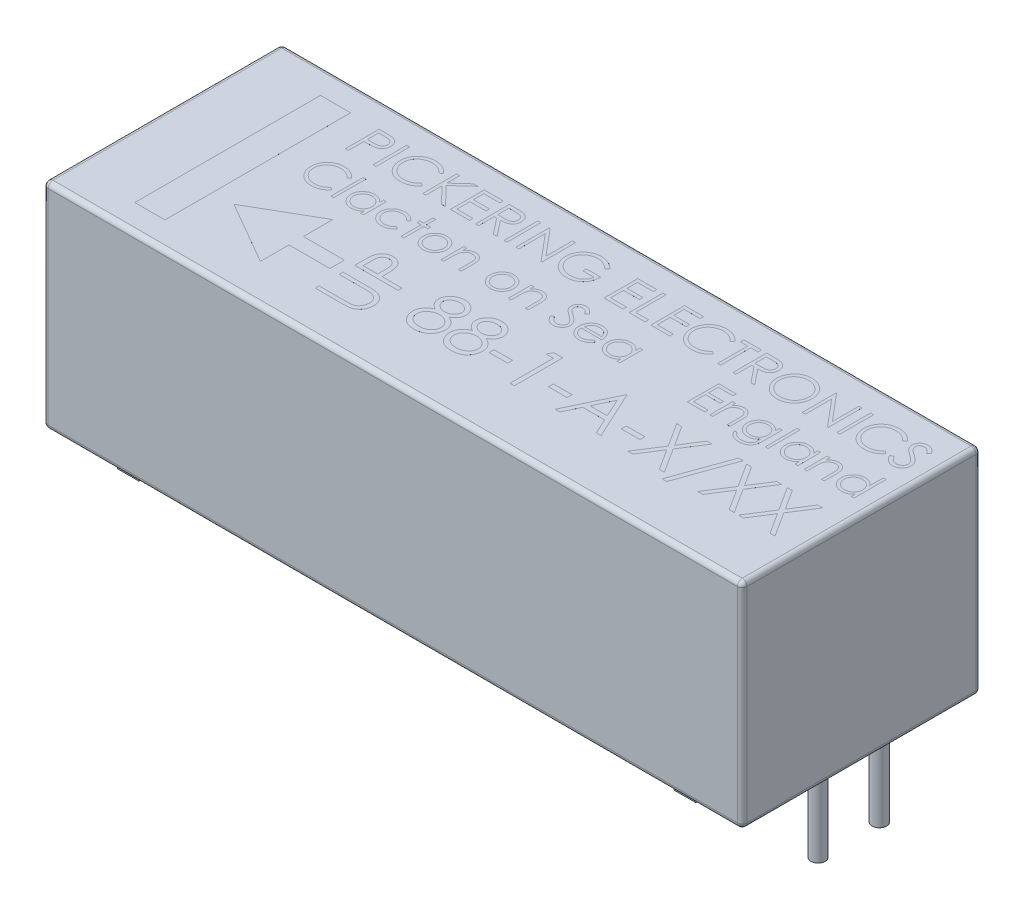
SolidWorks part; units mm, degrees
ref_plane "Front Plane" through (0, 0, 0) normal (0, 0, 1) x (1, 0, 0)
ref_plane "Top Plane" through (0, 0, 0) normal (0, 1, 0) x (1, 0, 0)
ref_plane "Right Plane" through (0, 0, 0) normal (1, 0, 0) x (0, 0, -1)
sketch "Sketch2" plane through (0, 0, 0) normal (0, 1, 0) x (1, 0, 0)
  line L1 (14.5, -4.95) -> (-14.5, -4.95)
  line L2 (14.5, -4.95) -> (14.5, 4.95)
  line L3 (14.5, 4.95) -> (-14.5, 4.95)
  line L4 (-14.5, -4.95) -> (-14.5, 4.95)
  line L5 (14.5, -4.95) -> (-14.5, 4.95) construction
  line L6 (14.5, 4.95) -> (-14.5, -4.95) construction
  point P0 (0, 0)
  dimension "D1" = 9.9
  dimension "D2" = 29
extrude "Main Body" add sketch "Sketch2" along normal blind 8.89 draft 0.023
sketch "Sketch3"
  dimension "D1" = 1.25
  dimension "D2" = 7.7
  dimension "D3" = 1.0965
  dimension "D4" = 2.7
  dimension "D5" = 1.4
  dimension "D6" = 2
extrude "Lettering" add sketch "Sketch3" along normal blind 0.0001
sketch "Sketch4" plane through (0, 0, 0) normal (0, -1, 0) x (1, 0, 0)
  line L0 (-14.5, -4.95) -> (-14.5, 4.95) construction
  line L1 (-12, 4.375) -> (-11.1, 4.375)
  line L2 (-12, 4.375) -> (-12, -4.375)
  line L3 (-12, -4.375) -> (-11.1, -4.375)
  line L4 (-11.1, 4.375) -> (-11.1, -4.375)
  line L5 (-14.5, 4.95) -> (14.5, 4.95) construction
  dimension "D1" = 8.75
  dimension "D2" = 0.9
  dimension "D3" = 2.5
  dimension "D4" = 0.575
extrude "Bobbin feet" add sketch "Sketch4" along normal blind 0.51
sketch "Sketch5" plane through (0, -0.51, 0) normal (0, -1, 0) x (1, 0, 0)
  line L0 (-11.1, -4.375) -> (-11.1, 4.375) construction
  line L1 (-11.1, -2.9375) -> (-12, -2.9375)
  line L2 (-11.1, -2.9375) -> (-11.1, -1.9375)
  line L3 (-11.1, -1.9375) -> (-12, -1.9375)
  line L4 (-12, -2.9375) -> (-12, -1.9375)
  line L5 (-12, 4.375) -> (-12, -4.375) construction
  line L6 (-12, 4.375) -> (-12, -4.375) construction
  line L7 (-12, -0.5) -> (-11.1, -0.5)
  line L8 (-12, -0.5) -> (-12, 0.5)
  line L9 (-12, 0.5) -> (-11.1, 0.5)
  line L10 (-11.1, -0.5) -> (-11.1, 0.5)
  line L11 (-11.1, 1.9375) -> (-12, 1.9375)
  line L12 (-11.1, 1.9375) -> (-11.1, 2.9375)
  line L13 (-11.1, 2.9375) -> (-12, 2.9375)
  line L14 (-12, 1.9375) -> (-12, 2.9375)
  line L15 (-12, -4.375) -> (-11.1, -4.375) construction
  dimension "D1" = 1.4375
  dimension "D2" = 1
  dimension "D3" = 1.4375
  dimension "D4" = 1
  dimension "D5" = 1
  dimension "D6" = 1.4375
extrude "Bobbin feet cut" cut sketch "Sketch5" against normal up to surface (0.51 mm away)
sketch "Sketch8" plane through (0, 0, 0) normal (0, -1, 0) x (1, 0, 0)
  line L0 (-14.5, -4.95) -> (-14.5, 4.95) construction
  line L1 (-12, -4.375) -> (-13.925, -4.375)
  line L2 (-12, -4.375) -> (-12, -2.9375)
  line L3 (-12, -2.9375) -> (-13.925, -2.9375)
  line L4 (-13.925, -4.375) -> (-13.925, -2.9375)
  line L5 (-12, -2.9375) -> (-11.1, -2.9375) construction
  dimension "D1" = 0.575
extrude "Extrude5" add sketch "Sketch8" along normal blind 0.1
pattern_linear "LPattern1" count 4 spacing 2.4385 along (0, 0, 1) of "Extrude5"
mirror "Mirror1" about plane through (0, 0, 0) normal (1, 0, 0) of "Extrude5", "Bobbin feet cut", "Bobbin feet", "LPattern1"
sketch "Sketch9" plane through (0, 0, 0) normal (0, -1, 0) x (1, 0, 0)
  line L0 (14.5, -4.95) -> (-14.5, -4.95) construction
  line L1 (14.5, 4.95) -> (14.5, -4.95) construction
  circle A0 centre (12.7, -2.54) radius 0.3
  circle A1 centre (12.7, 0) radius 0.2963
  dimension "D1" = 0.6
  dimension "D2" = 2.41
  dimension "D3" = 2.54
  dimension "D4" = 1.8
extrude "Pins" add sketch "Sketch9" along normal blind 4.31
mirror "Mirror2" about plane through (0, 0, 0) normal (1, 0, 0) of "Pins"
fillet "Fillet1" radius 0.2 12 edges at (-14.5, 0, 0) (0, 0, -4.95) (0, 0, 4.95) (14.5, 0, 0) (14.4983, 4.445, -4.9483) (-14.4983, 4.445, -4.9483) (-14.4983, 4.445, 4.9483) (14.4983, 4.445, 4.9483) (14.4965, 8.89, 0) (0, 8.89, -4.9465) (0, 8.89, 4.9465) (-14.4965, 8.89, 0)
sketch "Sketch11"
sketch_block_instance "UP-1"
sketch_block "Block2"
sketch_block_instance "Block1-1"
sketch_block "Block1" parameters "D1"=1.7, "D2"=2.2, "D3"=2.6, "D4"=1.24
extrude "up" add sketch "Sketch11" along normal blind 0.0001
